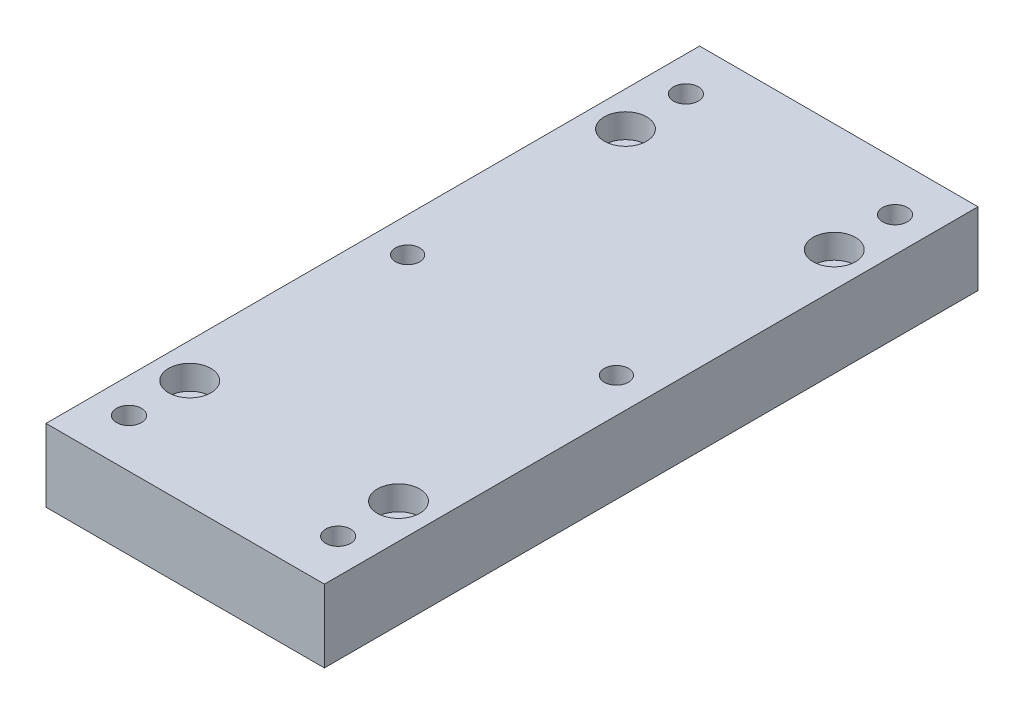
SolidWorks part; units mm, degrees
ref_plane "Front Plane" through (0, 0, 0) normal (0, 0, 1) x (1, 0, 0)
ref_plane "Top Plane" through (0, 0, 0) normal (0, 1, 0) x (1, 0, 0)
ref_plane "Right Plane" through (0, 0, 0) normal (1, 0, 0) x (0, 0, -1)
sketch "Sketch1" plane through (0, 0, 0) normal (0, 1, 0) x (1, 0, 0)
  line L1 (-36.5125, 85.725) -> (36.5125, 85.725)
  line L2 (-36.5125, 85.725) -> (-36.5125, -85.725)
  line L3 (-36.5125, -85.725) -> (36.5125, -85.725)
  line L4 (36.5125, 85.725) -> (36.5125, -85.725)
  line L5 (-36.5125, 85.725) -> (36.5125, -85.725) construction
  line L6 (-36.5125, -85.725) -> (36.5125, 85.725) construction
  point P0 (0, 0)
  dimension "D1" = 171.45
  dimension "D2" = 73.025
extrude "Boss-Extrude1" add sketch "Sketch1" along normal blind 19.05
hole_wizard "CBORE for 1/4 Socket Head Cap Screw1" positions "Sketch2" profile "Sketch3" counterbore size "1/4" standard "ANSI Inch"
sketch "Sketch2" plane through (0, 19.05, 0) normal (0, 1, 0) x (1, 0, 0)
  point P0 (-27.3812, 57.15)
  point P3 (-27.3812, -57.15)
  point P6 (27.3812, 57.15)
  point P9 (27.3812, -57.15)
sketch "Sketch3" plane through (-27.3812, 19.05, -57.15) normal (1, 0, 0) x (0, 0, 1)
  line L0 (0, 0) -> (0, 19.05)
  line L1 (0, 19.05) -> (3.3782, 19.05)
  line L3 (3.3782, 19.05) -> (3.3782, 6.35)
  line L4 (3.3782, 6.35) -> (5.5562, 6.35)
  line L5 (5.5562, 6.35) -> (5.5562, 0)
  line L7 (5.5562, 0) -> (0, 0)
  line L11 (0, -6.35) -> (0, 107.95) construction
  dimension "Thru Hole Dia." = 6.7564
  dimension "Thru Hole Depth" = 19.05
  dimension "C'Bore Dia." = 11.1125
  dimension "C'Bore Depth" = 6.35
hole_wizard "1/4 (0.2500) Dowel Hole1" positions "Sketch4" profile "Sketch5" hole size "1/4" standard "ANSI Inch"
sketch "Sketch4" plane through (0, 0, 0) normal (0, -1, 0) x (-1, 0, 0)
  point P0 (27.3812, 0)
  point P3 (-27.3812, 0)
sketch "Sketch5" plane through (-27.3812, 0, 0) normal (1, 0, 0) x (0, 0, -1)
  line L0 (0, 0) -> (0, 19.05)
  line L1 (0, 19.05) -> (3.175, 19.05)
  line L2 (3.175, 19.05) -> (3.175, 0)
  line L5 (3.175, 0) -> (0, 0)
  line L11 (0, -6.35) -> (0, 107.95) construction
  dimension "Thru Hole Dia." = 6.35
  dimension "Thru Hole Depth" = 19.05
hole_wizard "5/16-18 Tapped Hole1" positions "Sketch8" profile "Sketch9" tap size "5/16-18" standard "ANSI Inch"
sketch "Sketch8" plane through (0, 19.05, 0) normal (0, 1, 0) x (1, 0, 0)
  point P0 (-27.432, 73.0377)
  point P2 (27.432, 73.0377)
  point P4 (27.432, -73.0377)
  point P6 (-27.432, -73.0377)
sketch "Sketch9" plane through (-27.432, 19.05, -73.0377) normal (1, 0, 0) x (0, 0, 1)
  line L0 (0, 0) -> (0, 19.05)
  line L1 (0, 19.05) -> (3.2639, 19.05)
  line L2 (3.2639, 19.05) -> (3.2639, 0)
  line L5 (3.2639, 0) -> (0, 0)
  line L11 (0, -6.35) -> (0, 107.95) construction
  dimension "Thru Tap Drill Dia." = 6.5278
  dimension "Thru Tap Drill Depth" = 19.05
